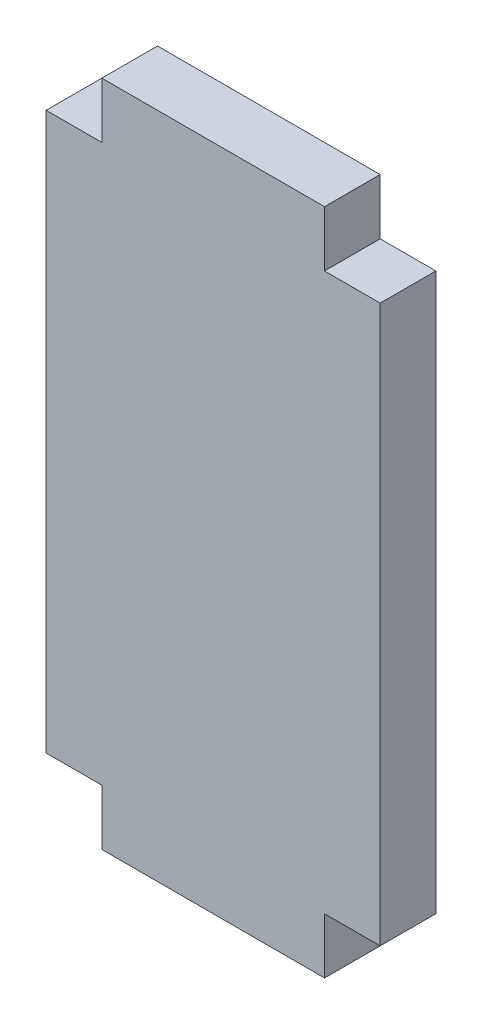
SolidWorks part; units mm, degrees
ref_plane "Front Plane" through (0, 0, 0) normal (0, 0, 1) x (1, 0, 0)
ref_plane "Top Plane" through (0, 0, 0) normal (0, 1, 0) x (1, 0, 0)
ref_plane "Right Plane" through (0, 0, 0) normal (1, 0, 0) x (0, 0, -1)
sketch "Sketch1" plane through (0, 0, 0) normal (0, 0, 1) x (1, 0, 0)
  line L1 (-9.525, 19.05) -> (9.525, 19.05)
  line L2 (-9.525, 19.05) -> (-9.525, -19.05)
  line L3 (-9.525, -19.05) -> (9.525, -19.05)
  line L4 (9.525, 19.05) -> (9.525, -19.05)
  line L5 (-9.525, 19.05) -> (9.525, -19.05) construction
  line L6 (-9.525, -19.05) -> (9.525, 19.05) construction
  point P0 (0, 0)
  dimension "D1" = 38.1
  dimension "D2" = 19.05
extrude "Boss-Extrude1" add sketch "Sketch1" along normal mid plane 3.175
sketch "Sketch2" plane through (0, 0, 1.5875) normal (0, 0, 1) x (1, 0, 0)
  line L0 (0, 20.7947) -> (0, -20.6055) construction
  line L1 (-9.525, 19.05) -> (-6.35, 19.05)
  line L2 (-9.525, 19.05) -> (-9.525, 15.875)
  line L3 (-9.525, 15.875) -> (-6.35, 15.875)
  line L4 (-6.35, 19.05) -> (-6.35, 15.875)
  line L5 (-12.9405, 0) -> (14.1707, 0) construction
  line L6 (6.35, 19.05) -> (6.35, 15.875)
  line L7 (9.525, 15.875) -> (6.35, 15.875)
  line L8 (9.525, 19.05) -> (9.525, 15.875)
  line L9 (9.525, 19.05) -> (6.35, 19.05)
  line L10 (9.525, -19.05) -> (6.35, -19.05)
  line L11 (9.525, -19.05) -> (9.525, -15.875)
  line L12 (9.525, -15.875) -> (6.35, -15.875)
  line L13 (6.35, -19.05) -> (6.35, -15.875)
  line L14 (-6.35, -19.05) -> (-6.35, -15.875)
  line L15 (-9.525, -15.875) -> (-6.35, -15.875)
  line L16 (-9.525, -19.05) -> (-9.525, -15.875)
  line L17 (-9.525, -19.05) -> (-6.35, -19.05)
  dimension "D1" = 3.175
  dimension "D2" = 3.175
extrude "Cut-Extrude1" cut sketch "Sketch2" against normal through all
